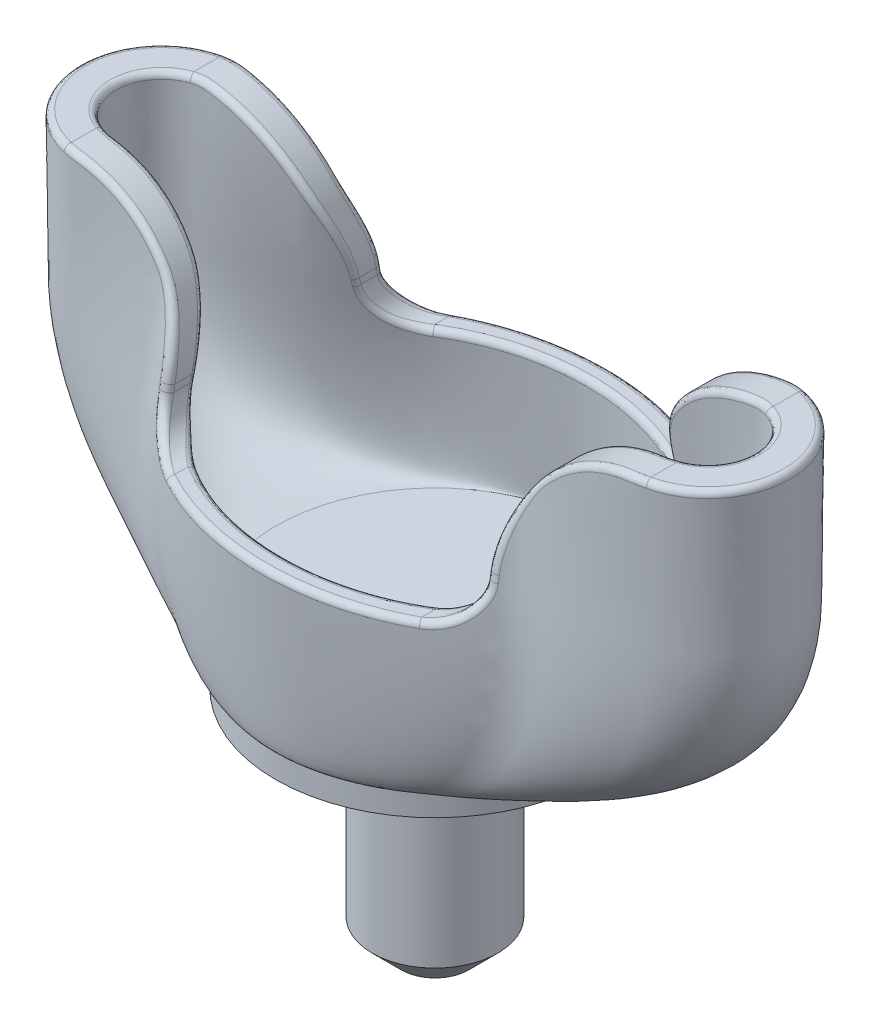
SolidWorks part; units mm, degrees
ref_plane "Front Plane" through (0, 0, 0) normal (0, 0, 1) x (1, 0, 0)
ref_plane "Top Plane" through (0, 0, 0) normal (0, 1, 0) x (1, 0, 0)
ref_plane "Right Plane" through (0, 0, 0) normal (1, 0, 0) x (0, 0, -1)
other "Configuration Table"
sketch "Sketch1" plane through (0, 0, 0) normal (0, 0, 1) x (1, 0, 0)
  line L0 (0, 10.7344) -> (0, -7.5424) construction
  line L1 (4.445, 5.334) -> (4.445, 6.5193)
  line L2 (-4.445, 0) -> (4.445, 0)
  line L3 (9.906, 10.16) -> (8.0857, 10.16)
  line L4 (-4.445, 5.334) -> (4.445, 5.334)
  line L5 (9.906, 10.16) -> (8.3762, 10.16) construction
  line L6 (9.906, 10.16) -> (9.906, 5.7504) construction
  line L7 (9.906, 10.16) -> (9.906, 6.1278)
  line L8 (4.445, 0) -> (4.445, 0.6667)
  line L9 (4.445, 0.6667) -> (0.3077, 0.6667) construction
  line L10 (-4.445, 0) -> (-4.445, 0.6667)
  line L11 (-9.906, 10.16) -> (-9.906, 6.1277)
  line L12 (-9.906, 10.16) -> (-8.0857, 10.16)
  line L13 (-4.445, 5.334) -> (-4.445, 6.5193)
  arc A5 (8.0857, 10.16) -> (4.445, 6.5193) centre (8.0857, 6.5193) ccw
  arc A6 (4.445, 0.6667) -> (9.906, 6.1278) centre (4.445, 6.1277) ccw
  arc A7 (-8.0857, 10.16) -> (-4.445, 6.5193) centre (-8.0857, 6.5193) cw
  arc A8 (-4.445, 0.6667) -> (-9.906, 6.1277) centre (-4.445, 6.1277) cw
  point P4 (0, 5.334)
  point P19 (0, 0)
ref_plane "Plane4" through (0, 10.16, 0) normal (0, 1, 0) x (-1, 0, 0)
ref_plane "Plane5" through (0, 0.6667, 0) normal (0, 1, 0) x (-1, 0, 0)
sketch "Sketch2" plane through (0, 10.16, 0) normal (0, 1, 0) x (-1, 0, 0)
  line L0 (4.445, 0) -> (-4.445, 0) construction
  line L1 (5.1243, -2.286) -> (7.62, -2.286)
  line L2 (0, 0) -> (14.2067, 0) construction
  line L3 (5.1243, 2.286) -> (7.62, 2.286)
  line L4 (0, 0) -> (0, 10.869) construction
  line L5 (0, 0) -> (0, -9.6836) construction
  line L6 (-5.1243, 2.286) -> (-7.62, 2.286)
  line L7 (-5.1243, -2.286) -> (-7.62, -2.286)
  arc A0 (4.2702, 2.7517) -> (-4.2702, 2.7517) centre (0, 0) ccw
  arc A1 (7.62, 2.286) -> (7.62, -2.286) centre (7.62, 0) cw
  arc A2 (-4.2702, -2.7517) -> (4.2702, -2.7517) centre (0, 0) ccw
  arc A3 (-7.62, 2.286) -> (-7.62, -2.286) centre (-7.62, 0) ccw
  arc A4 (-5.1243, 2.286) -> (-4.2702, 2.7517) centre (-5.1243, 3.302) ccw
  arc A5 (-5.1243, -2.286) -> (-4.2702, -2.7517) centre (-5.1243, -3.302) cw
  arc A6 (5.1243, 2.286) -> (4.2702, 2.7517) centre (5.1243, 3.302) cw
  arc A7 (5.1243, -2.286) -> (4.2702, -2.7517) centre (5.1243, -3.302) ccw
  point P20 (-4.5366, 2.286)
  point P23 (-4.5366, -2.286)
  point P26 (4.5366, 2.286)
  point P29 (4.5366, -2.286)
  dimension "F" = 10.16
  dimension "C" = 4.572
sketch "Sketch9" plane through (0, 0, 0) normal (0, 0, 1) x (1, 0, 0)
  line L0 (-9.906, 10.16) -> (-9.906, 6.1277) construction
  line L1 (-9.906, 10.16) -> (-9.906, 6.1277)
  arc A0 (-9.906, 6.1277) -> (-4.445, 0.6667) centre (-4.445, 6.1277) ccw construction
  arc A2 (-9.906, 6.1277) -> (-4.445, 0.6667) centre (-4.445, 6.1277) ccw
sketch "Sketch10" plane through (0, 0, 0) normal (0, 0, 1) x (1, 0, 0)
  line L0 (9.906, 10.16) -> (9.906, 6.1277) construction
  line L1 (9.906, 10.16) -> (9.906, 6.1277)
  arc A1 (4.445, 0.6668) -> (9.906, 6.1277) centre (4.445, 6.1277) ccw construction
  arc A2 (4.445, 0.6668) -> (9.906, 6.1277) centre (4.445, 6.1277) ccw
sketch "Sketch18" plane through (0, 0.6667, 0) normal (0, 1, 0) x (-1, 0, 0)
  circle A0 centre (0, 0) radius 4.445
loft "Loft2" add profiles "Sketch18", "Sketch2"
ref_plane "Plane6" through (0, 1.6827, 0) normal (0, 1, 0) x (-1, 0, 0)
sketch "Sketch20" plane through (0, 1.6827, 0) normal (0, 1, 0) x (-1, 0, 0)
  circle A0 centre (0, 0) radius 4.445 construction
  circle A1 centre (0, 0) radius 4.445
sketch "Sketch21" plane through (0, 10.16, 0) normal (0, 1, 0) x (-1, 0, 0)
  line L8 (-5.1243, 1.27) -> (-7.62, 1.27)
  line L9 (-7.62, -1.27) -> (-5.1243, -1.27)
  line L10 (5.1243, -1.27) -> (7.62, -1.27)
  line L11 (7.62, 1.27) -> (5.1243, 1.27)
  line L12 (-5.1243, 1.27) -> (-7.62, 1.27)
  line L13 (-7.62, -1.27) -> (-5.1243, -1.27)
  line L14 (5.1243, -1.27) -> (7.62, -1.27)
  line L15 (7.62, 1.27) -> (5.1243, 1.27)
  arc A16 (-7.62, 1.27) -> (-7.62, -1.27) centre (-7.62, 0) ccw
  arc A17 (-3.4162, -2.2013) -> (-5.1243, -1.27) centre (-5.1243, -3.302) ccw
  arc A18 (-3.4162, -2.2013) -> (3.4162, -2.2013) centre (0, 0) ccw
  arc A19 (5.1243, -1.27) -> (3.4162, -2.2013) centre (5.1243, -3.302) ccw
  arc A20 (7.62, -1.27) -> (7.62, 1.27) centre (7.62, 0) ccw
  arc A21 (3.4162, 2.2013) -> (5.1243, 1.27) centre (5.1243, 3.302) ccw
  arc A22 (3.4162, 2.2013) -> (-3.4162, 2.2013) centre (0, 0) ccw
  arc A23 (-5.1243, 1.27) -> (-3.4162, 2.2013) centre (-5.1243, 3.302) ccw
  arc A24 (-7.62, 1.27) -> (-7.62, -1.27) centre (-7.62, 0) ccw
  arc A25 (-3.4162, -2.2013) -> (-5.1243, -1.27) centre (-5.1243, -3.302) ccw
  arc A26 (-3.4162, -2.2013) -> (3.4162, -2.2013) centre (0, 0) ccw
  arc A27 (5.1243, -1.27) -> (3.4162, -2.2013) centre (5.1243, -3.302) ccw
  arc A28 (7.62, -1.27) -> (7.62, 1.27) centre (7.62, 0) ccw
  arc A29 (3.4162, 2.2013) -> (5.1243, 1.27) centre (5.1243, 3.302) ccw
  arc A30 (3.4162, 2.2013) -> (-3.4162, 2.2013) centre (0, 0) ccw
  arc A31 (-5.1243, 1.27) -> (-3.4162, 2.2013) centre (-5.1243, 3.302) ccw
sketch "Sketch22" plane through (0, 0, 0) normal (0, 0, 1) x (1, 0, 0)
  line L2 (-8.89, 10.16) -> (-8.89, 6.1277)
  line L3 (-8.89, 10.16) -> (-8.89, 6.1277)
  arc A2 (-8.89, 6.1277) -> (-4.445, 1.6827) centre (-4.445, 6.1277) ccw
  arc A3 (-8.89, 6.1277) -> (-4.445, 1.6827) centre (-4.445, 6.1277) ccw
sketch "Sketch23" plane through (0, 0, 0) normal (0, 0, 1) x (1, 0, 0)
  line L2 (8.89, 10.16) -> (8.89, 6.1277)
  line L3 (8.89, 10.16) -> (8.89, 6.1277)
  arc A2 (4.445, 1.6828) -> (8.89, 6.1277) centre (4.445, 6.1277) ccw
  arc A3 (4.445, 1.6828) -> (8.89, 6.1277) centre (4.445, 6.1277) ccw
loft "Cut-Loft1" cut profiles "Sketch20", "Sketch21"
sketch "Sketch14" plane through (0, 0, 0) normal (0, 0, 1) x (1, 0, 0)
  line L0 (0, 0) -> (0, -9.7552) construction
  line L2 (0, 0) -> (0, -6.35)
  line L3 (0, -6.35) -> (1.7526, -6.35)
  line L4 (1.7526, 0) -> (1.7526, -6.35)
  line L5 (1.7526, 0) -> (4.445, 0)
  line L6 (4.445, 0) -> (4.445, 0.6667)
  line L7 (4.445, 0.6667) -> (0, 0.6667)
  line L8 (0, 10.7344) -> (0, -7.5424) construction
  line L9 (6.9245, 0.6667) -> (-6.9245, 0.6667) construction
  line L10 (0, 0.6667) -> (0, 0)
revolve "Revolve1" add sketch "Sketch14" angle 360 about L0
sketch "Sketch16" plane through (0, 0, 0) normal (0, 0, 1) x (1, 0, 0)
  line L0 (-9.906, 10.16) -> (-9.906, 11.16)
  line L1 (-9.906, 11.16) -> (9.906, 11.16)
  line L2 (9.906, 11.16) -> (9.906, 10.16)
  line L10 (-4.445, 0) -> (4.445, 0)
  line L11 (4.445, 0) -> (4.445, 0.6667)
  line L12 (9.906, 6.1277) -> (9.906, 10.16)
  line L13 (9.906, 10.16) -> (8.0857, 10.16)
  line L14 (4.445, 6.5193) -> (4.445, 5.334)
  line L15 (4.445, 5.334) -> (-4.445, 5.334)
  line L16 (-4.445, 5.334) -> (-4.445, 6.5193)
  line L17 (-8.0857, 10.16) -> (-9.906, 10.16)
  line L18 (-9.906, 10.16) -> (-9.906, 6.1277)
  line L19 (-4.445, 0.6667) -> (-4.445, 0)
  line L23 (9.906, 10.16) -> (8.0857, 10.16)
  line L24 (4.445, 6.5193) -> (4.445, 5.334)
  line L25 (4.445, 5.334) -> (-4.445, 5.334)
  line L26 (-4.445, 5.334) -> (-4.445, 6.5193)
  line L27 (-8.0857, 10.16) -> (-9.906, 10.16)
  arc A4 (4.445, 0.6667) -> (9.906, 6.1277) centre (4.445, 6.1277) ccw
  arc A5 (8.0857, 10.16) -> (4.445, 6.5193) centre (8.0857, 6.5193) ccw
  arc A6 (-4.445, 6.5193) -> (-8.0857, 10.16) centre (-8.0857, 6.5193) ccw
  arc A7 (-9.906, 6.1277) -> (-4.445, 0.6667) centre (-4.445, 6.1277) ccw
  arc A9 (8.0857, 10.16) -> (4.445, 6.5193) centre (8.0857, 6.5193) ccw
  arc A10 (-4.445, 6.5193) -> (-8.0857, 10.16) centre (-8.0857, 6.5193) ccw
  dimension "D2" = 1
  dimension "D1" = 0
extrude "Cut-Extrude1" cut sketch "Sketch16" against normal through all and the other way through all
fillet "Fillet1" radius 1 4 edges at (4.445, 5.334, -2.924) (4.445, 5.334, 2.924) (-4.445, 5.334, -2.924) (-4.445, 5.334, 2.924)
fillet "Fillet2" radius 0.1693 32 edges at (-5.4656, 9.0471, -1.4153) (-5.968, 9.4808, 1.3386) (-4.1482, 5.623, -2.6418) (0.7192, 5.334, -4.1865) (4.2763, 5.7781, -2.5192) (5.4656, 9.0471, 1.4153) (5.968, 9.4808, -1.3386) (4.1482, 5.623, 2.6418) (-0.7192, 5.334, 4.1865) (-4.2763, 5.7781, 2.5192) (-5.3715, 8.9458, 2.3716) (-5.3444, 8.9152, -2.375) (-4.2761, 5.7779, -3.4455) (1.9112, 5.334, -4.5997) (4.1338, 5.609, -3.5649) (5.3444, 8.9152, 2.375) (5.3715, 8.9458, -2.3716) (4.2761, 5.7779, 3.4455) (-1.9112, 5.334, 4.5997) (-4.1338, 5.609, 3.5649)
sketch "Sketch27" plane through (0, 0, 0) normal (0, 0, 1) x (1, 0, 0)
  line L0 (0, 0) -> (0, -9.1725) construction
  line L1 (-4.445, 0) -> (4.445, 0) construction
  line L2 (0.9398, -6.35) -> (0.9398, -6.604)
  line L4 (-1.7526, -6.35) -> (1.7526, -6.35) construction
  line L5 (0.9398, -6.604) -> (1.9279, -6.604)
  line L6 (1.9279, -6.604) -> (1.9279, -5.3619)
  line L7 (1.9279, -5.3619) -> (0.9398, -6.35)
revolve "Cut-Revolve11" cut sketch "Sketch27" angle 360 about L0
sketch "Sketch26" plane through (0, 0, 0) normal (0, 0, 1) x (1, 0, 0)
  line L0 (0, 0) -> (0, -6.8807) construction
  line L1 (-1.7526, 0) -> (1.7526, 0) construction
  line L2 (1.2802, -0.2753) -> (1.7526, -0.0025)
  line L3 (1.7526, -0.0025) -> (1.7526, -0.5481)
  line L4 (1.7526, -0.5481) -> (1.2802, -0.2753)
  line L9 (1.2802, -0.2753) -> (1.2802, -1.0678) construction
revolve "Cut-Revolve10" [suppressed] cut sketch "Sketch26" angle 360 about L0
pattern_linear "LPattern10" [suppressed] count 8 along (0, -1, 0)
equation "\"D1@Sketch1\" = (  \"A@Sketch1\" - \"EE@Sketch1\"  ) / 2 / 3"
equation "\"D2@Sketch1\" = \"G@Sketch1\" / 8"
equation "\"D1@LPattern10\" =\"L@Sketch14\" / \"pitch@Sketch26\" "
equation "\"EE@Sketch1\" = \"E@Sketch1\""
equation "\"LL@Cosmetic Thread1\" = \"L@Sketch14\""
equation "\"D3@Sketch27\" = \"d1@Sketch14\" * 1.1 / 2"
equation "\"D1@Fillet2\" = \"T\" / 6"
equation "\"D1@Sketch26\" = \"d1@Sketch14\""
equation "\"D2@Sketch26\" = \"THD_MINOR@Cosmetic Thread1\""
equation "\"PITCH@LPattern10\" = \"pitch@Sketch26\""
